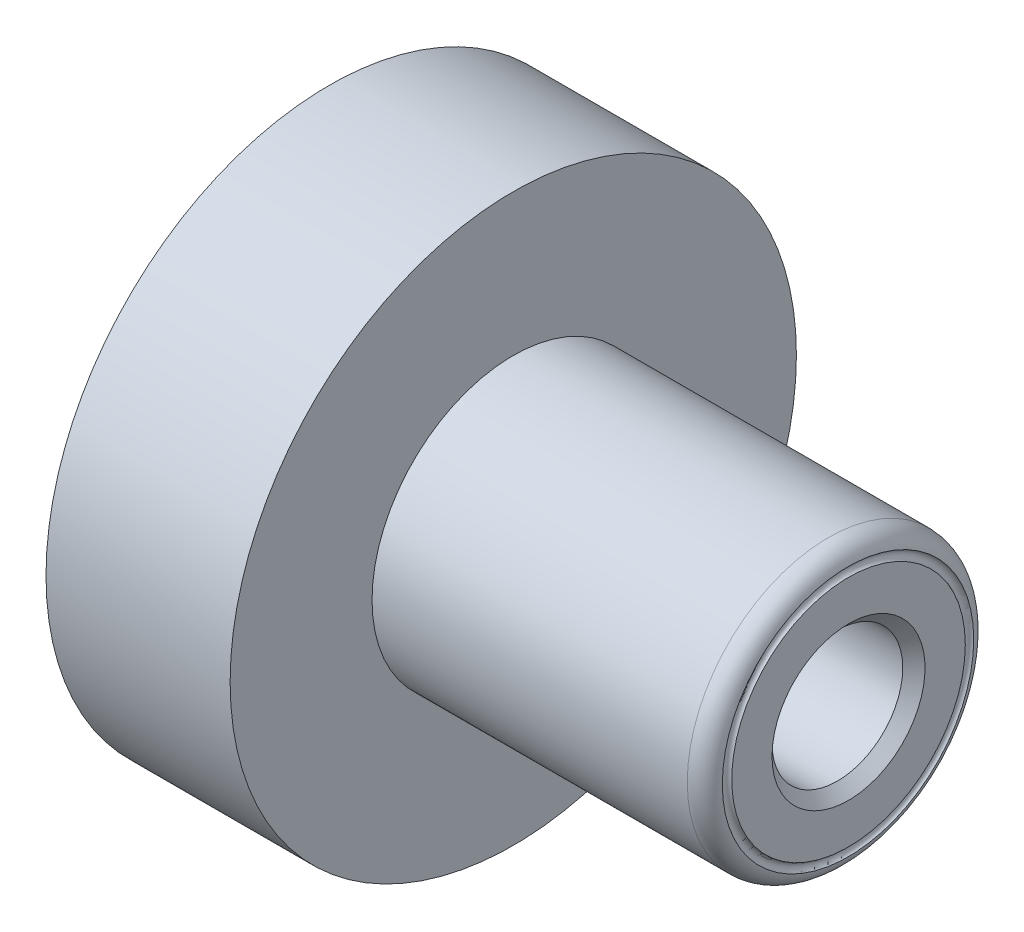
SolidWorks part; units mm, degrees
ref_plane "Front Plane" through (0, 0, 0) normal (0, 0, 1) x (1, 0, 0)
ref_plane "Top Plane" through (0, 0, 0) normal (0, 1, 0) x (1, 0, 0)
ref_plane "Right Plane" through (0, 0, 0) normal (1, 0, 0) x (0, 0, -1)
sketch "Sketch1" plane through (0, 0, 0) normal (0, 0, 1) x (1, 0, 0)
  line L0 (0, 0) -> (102.3864, 0) construction
  line L1 (0, 8.128) -> (0, 22.225)
  line L2 (0, 22.225) -> (14.4526, 22.225)
  line L3 (14.4526, 22.225) -> (14.4526, 11.0871)
  line L4 (14.4526, 11.0871) -> (39.197, 11.0871)
  line L5 (40.767, 9.5171) -> (40.767, 0)
  line L6 (40.767, 0) -> (28.067, 0)
  line L7 (0, 8.128) -> (28.067, 8.128)
  line L8 (28.067, 8.128) -> (28.067, 0)
  arc A0 (40.767, 9.5171) -> (39.197, 11.0871) centre (39.197, 9.5171) ccw
  dimension "D5" = 1.57
  dimension "D1" = 14.4526
  dimension "D2" = 44.45
  dimension "D3" = 28.067
  dimension "D4" = 16.256
  dimension "D6" = 40.767
  dimension "D7" = 22.1742
revolve "Revolve1" add sketch "Sketch1" angle 360 about L0
sketch "Sketch2" plane through (0, 0, 0) normal (-1, 0, 0) x (0, 0, 1)
  line L0 (0, 0) -> (0, 9.7644) construction
  circle A0 centre (-12.7, 0) radius 3.2004
  circle A1 centre (12.7, 0) radius 3.2004
  dimension "D2" = 6.4008
  dimension "D1" = 25.4
extrude "Cut-Extrude1" cut sketch "Sketch2" against normal blind 7.9502
sketch "Sketch3" plane through (40.767, 0, 0) normal (1, 0, 0) x (0, 0, -1)
  circle A0 centre (0, 0) radius 5.13
  dimension "D1" = 10.26
extrude "Cut-Extrude2" cut sketch "Sketch3" against normal through all
chamfer "Chamfer1" distance 0.875 angle 45 1 edges at (40.767, 0, -5.13)
sketch "Sketch4" plane through (0, 0, 0) normal (0, 0, 1) x (1, 0, 0)
  line L0 (0, 0) -> (46.209, 0) construction
  line L1 (0, 22.225) -> (0, -22.225) construction
  circle A0 centre (40.897, 9.525) radius 0.381
  dimension "D1" = 9.525
  dimension "D2" = 40.897
  dimension "D3" = 0.381
revolve "Cut-Revolve1" cut sketch "Sketch4" angle 360 about L0
